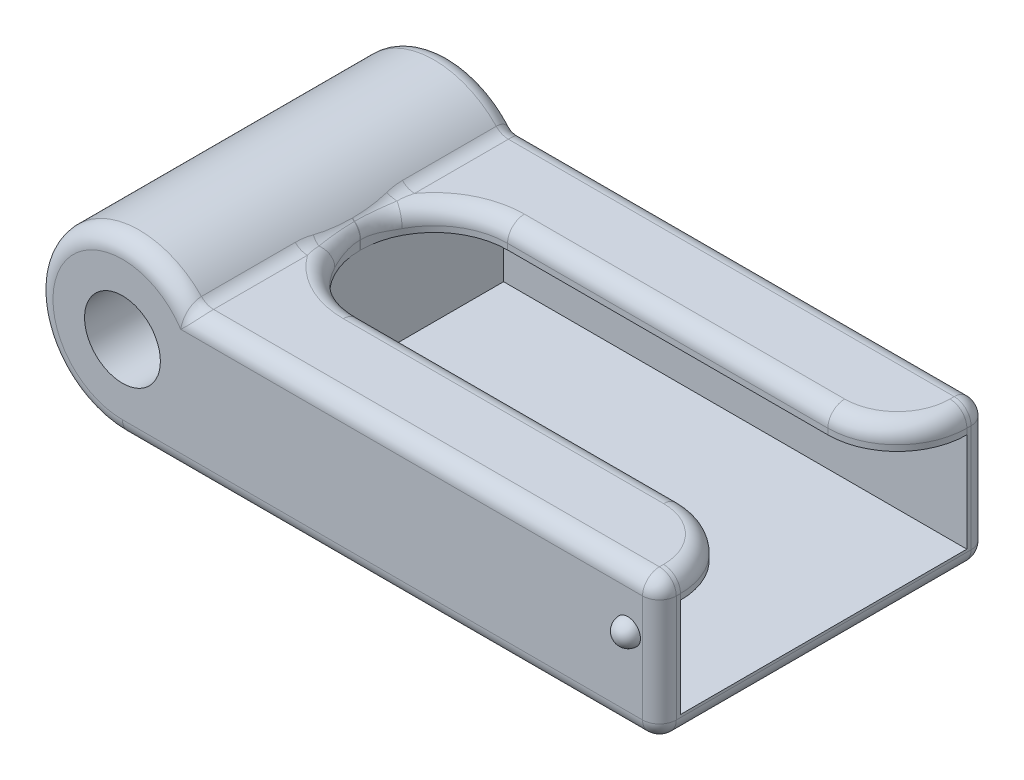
SolidWorks part; units mm, degrees
ref_plane "Plan de face" through (0, 0, 0) normal (0, 0, 1) x (1, 0, 0)
ref_plane "Plan de dessus" through (0, 0, 0) normal (0, 1, 0) x (1, 0, 0)
ref_plane "Plan de droite" through (0, 0, 0) normal (1, 0, 0) x (0, 0, -1)
sketch "Esquisse1" plane through (0, 0, 0) normal (0, 0, 1) x (1, 0, 0)
  line L0 (-26.893, 0) -> (4.3815, 0) construction
  line L1 (0, 23.3763) -> (0, -28.3411) construction
  line L2 (0, -4.1) -> (28.2491, -4.1) construction
  line L3 (0, 4.1) -> (38.3372, 4.1) construction
  line L4 (2.2491, 2.6) -> (39.4664, 2.6) construction
  line L5 (1.2823, -3.1) -> (28.2491, -3.1) construction
  line L7 (3.5, 1.3432) -> (3.5, -4.1096) construction
  line L8 (25.5, 2.6) -> (25.5, -13.5069) construction
  line L9 (2.5971, 1.6) -> (38.3372, 1.6) construction
  line L10 (0, -4.1) -> (25.5, -4.1)
  line L11 (25.5, -4.1) -> (25.5, 2.6)
  line L12 (25.5, 2.6) -> (3.1702, 2.6)
  line L13 (1.5921, 3) -> (40.7284, 3) construction
  line L14 (35.5, 9.1268) -> (35.5, -17.0221) construction
  circle A0 centre (0, 0) radius 1.8 construction
  circle A1 centre (0, 0) radius 2 construction
  circle A2 centre (0, 0) radius 4.1 construction
  arc A3 (3.1702, 2.6) -> (0, -4.1) centre (0, 0) ccw
  circle A4 centre (0, 0) radius 1.8
  dimension "D1" = 1.5
  dimension "D3" = 3.5
  dimension "D6" = 1
  dimension "D7" = 1.1
  dimension "D2" = 1
  dimension "D4" = 22
  dimension "D5" = 4.7
  dimension "D8" = 10
extrude "Boss.-Extru.1" add sketch "Esquisse1" along normal mid plane 15.6
sketch "Esquisse2" plane through (25.5, 0, 0) normal (1, 0, 0) x (0, 0, -1)
  line L0 (0, 4.1) -> (0, -5.7493) construction
  line L1 (7.8, 4.1) -> (-7.8, 4.1) construction
  line L2 (7.8, -0.75) -> (-12.7516, -0.75) construction
  line L4 (7.8, -4.1) -> (7.8, 2.6) construction
  line L6 (-6.8, -3.1746) -> (6.8, -3.1746)
  line L7 (-6.8, -3.1746) -> (-6.8, 1.5254)
  line L8 (-6.8, 1.5254) -> (6.8, 1.5254)
  line L11 (6.8, -3.1746) -> (6.8, 1.5254)
  line L12 (-6.8, -3.1746) -> (6.8, 1.5254) construction
  line L13 (-6.8, 1.5254) -> (6.8, -3.1746) construction
  point P8 (0, 0)
  point P14 (0, -0.8246)
  dimension "D1" = 4.7
  dimension "D2" = 13.6
extrude "Enlèv. mat.-Extru.1" cut sketch "Esquisse2" against normal blind 22
sketch "Esquisse3" plane through (0, 2.6, 0) normal (0, 1, 0) x (1, 0, 0)
  line L0 (27.3998, 0) -> (-5.983, 0) construction
  line L1 (3.5, 6.8) -> (3.5, -6.8) construction
  line L2 (38.2218, -3.5) -> (6.99, -3.5)
  line L3 (38.2218, -3.5) -> (38.2218, 3.5)
  line L4 (38.2218, 3.5) -> (6.99, 3.5)
  line L5 (3.5, -0.01) -> (3.5, 0.01)
  line L6 (38.2218, -3.5) -> (3.5, 3.5) construction
  line L7 (38.2218, 3.5) -> (3.5, -3.5) construction
  arc A0 (6.99, -3.5) -> (3.5, -0.01) centre (6.99, -0.01) cw
  arc A1 (6.99, 3.5) -> (3.5, 0.01) centre (6.99, 0.01) ccw
  point P3 (20.8609, 0)
  dimension "D2" = 3.49
  dimension "D1" = 7
extrude "Enlèv. mat.-Extru.2" cut sketch "Esquisse3" against normal up to surface (5.7746 mm away)
fillet "Congé1" radius 3.3 2 edges at (25.5, 2.0627, 3.5) (25.5, 2.0627, -3.5)
fillet "Congé2" radius 0.8 17 edges at (25.5, 2.6, 7.3) (24.5335, 2.6, 4.4665) (14.595, 2.6, 3.5) (4.5222, 2.6, 2.4778) (4.5222, 2.6, -2.4778) (14.595, 2.6, -3.5) (25.5, 2.6, -7.3) (-3.7061, 1.7536, -7.8) (-3.7061, 1.7536, 7.8) (25.5, -4.1, 0) (25.5, -0.75, 7.8) (24.5335, 2.6, -4.4665) (25.5, -0.75, -7.8) (12.75, -4.1, -7.8) (14.3351, 2.6, -7.8) (12.75, -4.1, 7.8) (14.3351, 2.6, 7.8)
fillet "Congé3" radius 0.8 7 edges at (3.0996, 2.4525, 7.4629) (3.1702, 2.6, 4.4813) (3.1702, 2.6, 0.9863) (3.1702, 2.6, 0) (3.1702, 2.6, -0.9863) (3.0996, 2.4525, -7.4629) (3.1702, 2.6, -4.4813)
sketch "Esquisse4" plane through (0, 0, 0) normal (0, 1, 0) x (1, 0, 0)
  line L0 (24, 10.9001) -> (24, -10.5886) construction
  line L1 (0, -7) -> (0, 7) construction
  line L2 (6.99, 0.01) -> (29.9741, 0.01) construction
  line L3 (19.1086, 7.8) -> (28.4515, 7.8) construction
  line L4 (2.7659, 7.8) -> (24.7, 7.8) construction
  line L5 (24, 8.4) -> (24, 7.2)
  line L6 (24, -8.38) -> (24, -7.18)
  arc A0 (24, 8.4) -> (24, 7.2) centre (24, 7.8) ccw
  arc A1 (24, -8.38) -> (24, -7.18) centre (24, -7.78) cw
  dimension "D1" = 24
revolve "Révolution1" add sketch "Esquisse4" angle 360 about L0
